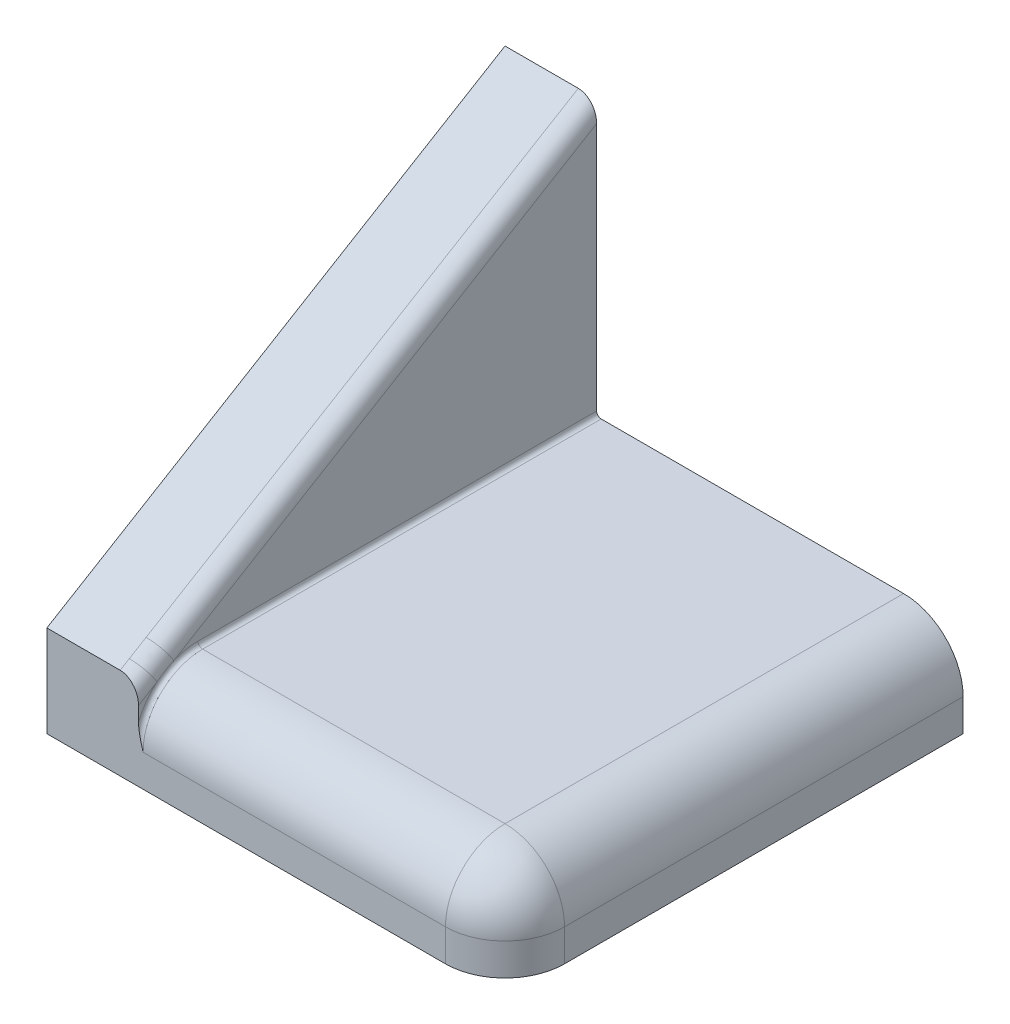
SolidWorks part; units mm, degrees
ref_plane "Front Plane" through (0, 0, 0) normal (0, 0, 1) x (1, 0, 0)
ref_plane "Top Plane" through (0, 0, 0) normal (0, 1, 0) x (1, 0, 0)
ref_plane "Right Plane" through (0, 0, 0) normal (1, 0, 0) x (0, 0, -1)
sketch "Sketch4" plane through (0, 0, 0) normal (0, 1, 0) x (1, 0, 0)
  line L1 (-25.9454, 18.2773) -> (24.0546, 18.2773)
  line L2 (-25.9454, 18.2773) -> (-25.9454, -31.7227)
  line L3 (-25.9454, -31.7227) -> (24.0546, -31.7227)
  line L4 (24.0546, 18.2773) -> (24.0546, -31.7227)
  dimension "D1" = 50
  dimension "D2" = 50
extrude "Boss-Extrude1" add sketch "Sketch4" along normal blind 10 contours L4 L3 L2 L1
sketch "Sketch6" plane through (-25.9454, 0, 0) normal (-1, 0, 0) x (0, 0, 1)
  line L0 (-18.2773, 10) -> (-18.2773, 40)
  line L1 (-18.2773, 40) -> (31.7227, 10)
  line L2 (31.7227, 10) -> (-18.2773, 10)
  dimension "D1" = 30
extrude "Boss-Extrude2" add sketch "Sketch6" against normal blind 10
fillet "Fillet2" radius 6.5 1 edges at (4.0546, 10, 31.7227)
fillet "Fillet3" radius 0.5 2 edges at (-15.9454, 8.0962, 29.8189) (-15.9454, 10, 3.4727)
fillet "Fillet4" radius 2 1 edges at (-15.9454, 25, 6.7227)
fillet "Fillet5" radius 6.5 3 edges at (24.0546, 10, 3.4727) (24.0546, 1.75, 31.7227) (24.0546, 8.0962, 29.8189)
